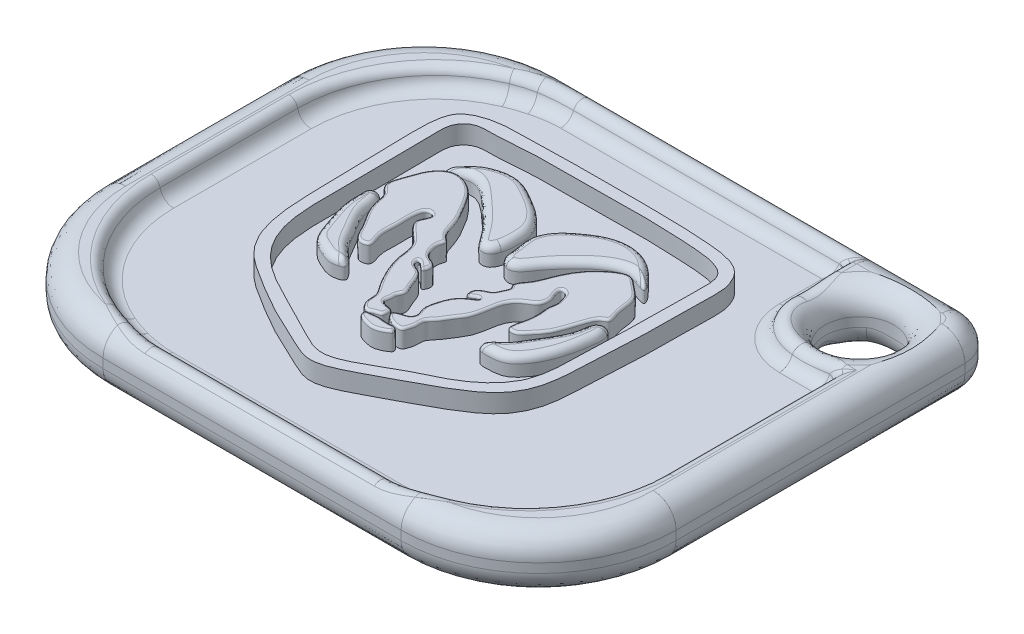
SolidWorks part; units mm, degrees
ref_plane "Ön Düzlem" through (0, 0, 0) normal (0, 0, 1) x (1, 0, 0)
ref_plane "Üst Düzlem" through (0, 0, 0) normal (0, 1, 0) x (1, 0, 0)
ref_plane "Sağ Düzlem" through (0, 0, 0) normal (1, 0, 0) x (0, 0, -1)
sketch "Çizim1" plane through (0, 0, 0) normal (0, 1, 0) x (1, 0, 0)
  line L1 (-41.6667, 37.8333) -> (53.3333, 37.8333)
  line L2 (-71.6667, 7.8333) -> (-71.6667, -32.1667)
  line L3 (-41.6667, -62.1667) -> (23.3333, -62.1667)
  line L4 (53.3333, 37.8333) -> (53.3333, -32.1667)
  arc A0 (23.3333, -62.1667) -> (53.3333, -32.1667) centre (23.3333, -32.1667) ccw
  arc A1 (-71.6667, -32.1667) -> (-41.6667, -62.1667) centre (-41.6667, -32.1667) ccw
  arc A2 (-41.6667, 37.8333) -> (-71.6667, 7.8333) centre (-41.6667, 7.8333) ccw
  circle A3 centre (38.3333, 22.8333) radius 7.5
  point P8 (-71.6667, -62.1667)
  point P11 (-71.6667, 37.8333)
  dimension "D3" = 30
  dimension "D4" = 15
  dimension "D1" = 100
  dimension "D2" = 125
  dimension "D5" = 15
extrude "Yükseklik-Ekstrüzyon1" add sketch "Çizim1" along normal blind 12
sketch "Çizim2" plane through (0, 12, 0) normal (0, 1, 0) x (1, 0, 0)
  line L0 (53.3333, 37.8333) -> (-41.6667, 37.8333) construction
  line L1 (-34.1667, 32.8333) -> (25.8333, 32.8333)
  line L2 (-64.1667, 2.8333) -> (-64.1667, -27.1667)
  line L3 (-34.1667, -57.1667) -> (15.8333, -57.1667)
  line L4 (45.8333, 10.8333) -> (45.8333, -27.1667)
  line L5 (-71.6667, 7.8333) -> (-71.6667, -32.1667) construction
  line L8 (25.8333, 32.8333) -> (25.8333, 20.8333)
  line L9 (35.8333, 10.8333) -> (45.8333, 10.8333)
  arc A0 (15.8333, -57.1667) -> (45.8333, -27.1667) centre (15.8333, -27.1667) ccw
  arc A1 (-64.1667, -27.1667) -> (-34.1667, -57.1667) centre (-34.1667, -27.1667) ccw
  arc A2 (-34.1667, 32.8333) -> (-64.1667, 2.8333) centre (-34.1667, 2.8333) ccw
  arc A3 (25.8333, 20.8333) -> (35.8333, 10.8333) centre (35.8333, 20.8333) ccw
  point P8 (-64.1667, -57.1667)
  point P11 (-64.1667, 32.8333)
  dimension "D3" = 30
  dimension "D8" = 10
  dimension "D1" = 90
  dimension "D2" = 110
  dimension "D4" = 5
  dimension "D5" = 7.5
extrude "Kes-Ekstrüzyon1" cut sketch "Çizim2" against normal blind 4
sketch "Çizim3" plane through (0, 0, 0) normal (0, -1, 0) x (1, 0, 0)
  line L0 (-41.6667, 62.1667) -> (23.3333, 62.1667) construction
  line L1 (-34.1667, 57.1667) -> (15.8333, 57.1667)
  line L2 (-64.1667, 27.1667) -> (-64.1667, -2.8333)
  line L3 (-34.1667, -32.8333) -> (25.8333, -32.8333)
  line L4 (45.8333, 27.1667) -> (45.8333, -10.8333)
  line L6 (-71.6667, -7.8333) -> (-71.6667, 32.1667) construction
  line L11 (25.8333, -32.8333) -> (25.8333, -20.8333)
  line L12 (35.8333, -10.8333) -> (45.8333, -10.8333)
  arc A0 (25.8333, -20.8333) -> (35.8333, -10.8333) centre (35.8333, -20.8333) cw
  arc A1 (-64.1667, -2.8333) -> (-34.1667, -32.8333) centre (-34.1667, -2.8333) ccw
  arc A2 (-34.1667, 57.1667) -> (-64.1667, 27.1667) centre (-34.1667, 27.1667) ccw
  arc A3 (15.8333, 57.1667) -> (45.8333, 27.1667) centre (15.8333, 27.1667) cw
  point P14 (25.8333, -10.8333)
  point P15 (-64.1667, -32.8333)
  point P18 (-64.1667, 57.1667)
  dimension "D7" = 10
  dimension "D1" = 30
  dimension "D2" = 90
  dimension "D3" = 5
  dimension "D4" = 7.5
  dimension "D5" = 22
  dimension "D6" = 20
extrude "Kes-Ekstrüzyon2" cut sketch "Çizim3" against normal blind 4
fillet "Radyus11" radius 5 15 edges at (5.8333, 12, -37.8333) (53.3333, 12, -2.8333) (44.5465, 12, 53.3799) (-9.1667, 12, 62.1667) (-62.8799, 12, 53.3799) (-71.6667, 12, 12.1667) (5.8333, 0, -37.8333) (53.3333, 0, -2.8333) (44.5465, 0, 53.3799) (-9.1667, 0, 62.1667) (-62.8799, 0, 53.3799) (-71.6667, 0, 12.1667) (38.3333, 12, -15.3333) (-62.8799, 12, -29.0465) (-62.8799, 0, -29.0465)
fillet "Radyus12" radius 5 1 edges at (38.3333, 0, -15.3333)
fillet "Radyus13" radius 3 10 edges at (-64.1667, 4, 12.1667) (-55.3799, 4, 48.3799) (-9.1667, 4, 57.1667) (37.0465, 4, 48.3799) (45.8333, 4, 8.1667) (40.8333, 4, -10.8333) (28.7623, 4, -13.7623) (25.8333, 4, -26.8333) (-4.1667, 4, -32.8333) (-55.3799, 4, -24.0465)
fillet "Radyus14" radius 3 2 edges at (25.8333, 0, -27.8333) (38.8331, 0.024, -10.8333)
fillet "Radyus15" radius 3 4 edges at (27.2654, 0.2614, -32.8333) (45.8333, 0.3856, -12.0869) (24.5654, 3.4495, -31.5654) (44.5447, 3.464, -9.5447)
fillet "Radyus18" radius 2 7 edges at (-55.3799, 12, -24.0465) (-64.1667, 12, 12.1667) (-9.1667, 12, 57.1667) (37.0465, 12, 48.3799) (-55.3799, 12, 48.3799) (-4.1667, 12, -32.8333) (45.8333, 12, 8.1667)
fillet "Radyus19" radius 7 3 edges at (51.8689, 1.4645, -36.3689) (51.8689, 10.5355, -36.3689) (53.3333, 6, -37.8333)
fillet "Radyus20" radius 3 10 edges at (40.8333, 8, -10.8333) (25.8333, 8, -26.8333) (-4.1667, 8, -32.8333) (45.8333, 8, 8.1667) (37.0465, 8, 48.3799) (-9.1667, 8, 57.1667) (-55.3799, 8, 48.3799) (-64.1667, 8, 12.1667) (28.7623, 8, -13.7623) (-55.3799, 8, -24.0465)
fillet "Radyus23" radius 2 6 edges at (44.8333, 12, -10.8333) (38.8333, 11.976, -10.8333) (25.8333, 12, -21.8333) (25.8333, 11.6709, -34.6174) (25.8333, 12, -27.8333)
fillet "Radyus24" radius 2 5 edges at (24.5399, 8.5327, -31.8614) (44.8317, 8.6762, -9.7307) (26.2034, 11.1204, -34.163) (46.5684, 11.5492, -11.4674)
sketch "Çizim4" plane through (0, 8, 0) normal (0, 1, 0) x (1, 0, 0)
  line L0 (151.5834, 553.2835) -> (951.5834, 553.2835) construction
  spline S0 degree 3 poles (15.953, 19.5866) (18.3588, 13.6674) (17.8839, 8.4144) (18.0922, 2.0295) (17.843, -6.304) (17.1688, -15.1893) (17.1255, -23.2659) (13.9873, -30.5642) (5.9124, -36.0113) (-2.628, -40.2402) (-9.3589, -43.9103) (-14.4223, -45.4916) (-20.4751, -42.3304) (-27.6236, -39.3057) (-34.4255, -34.9384) (-40.2998, -31.3335) (-43.5865, -26.0012) (-44.9039, -19.6326) (-45.122, -13.709) (-45.2462, -7.1627) (-45.4639, -1.3376) (-45.3847, 6.0632) (-45.8894, 11.8747) (-44.6406, 18.0281) (-38.8211, 20.7841) (-31.8787, 20.5257) (-21.3881, 20.9668) (-8.0529, 20.9111) (4.8279, 20.9052) (15.953, 19.5866) (18.3588, 13.6674) (17.8839, 8.4144) knots -0.133499 -0.058408 -0.019482 0 0.020891 0.051961 0.086482 0.133802 0.173147 0.194653 0.238604 0.299791 0.324988 0.343401 0.368235 0.412481 0.450536 0.477463 0.504761 0.532426 0.5649 0.585024 0.621189 0.643988 0.685035 0.701469 0.724204 0.763255 0.796423 0.866501 0.941592 0.980518 1 1.020891 1.051961 1.086482 only from (17.9684, 13.7831) to (17.9684, 13.7831)
  spline S1 degree 3 poles (-42.6128, -7.7362) (-42.7896, 5.0818) (-42.9813, 15.1106) (-40.2853, 17.8545) (-35.8586, 17.5748) (-28.8839, 18.4449) (-19.9801, 18.1643) (-7.4294, 18.5933) (2.6937, 18.4183) (15.4637, 17.4118) (15.3469, 7.3012) (15.3811, -2.076) (14.6546, -14.2547) (14.9138, -25.0869) (7.3638, -32.8571) (-1.3545, -36.226) (-7.9311, -40.5853) (-14.3, -43.1101) (-19.9203, -40.0129) (-28.1594, -35.6847) (-37.0032, -31.8464) (-42.806, -21.8925) (-42.6128, -7.7362) (-42.7896, 5.0818) (-42.9813, 15.1106) knots -0.198126 -0.17852 -0.109927 0 0.016984 0.031549 0.050026 0.078671 0.135548 0.180319 0.258801 0.304453 0.322538 0.393706 0.448328 0.501615 0.544201 0.596306 0.637495 0.66139 0.690583 0.724591 0.801874 0.82148 0.890073 1 1.016984 1.031549 1.050026 only from (-42.9165, 11.6824) to (-42.9165, 11.6824)
  spline S2 degree 3 poles (-38.5956, -4.7526) (-40.4193, -5.2577) (-40.349, -7.8522) (-40.4349, -11.5939) (-38.6653, -16.0872) (-37.2614, -20.6435) (-33.8173, -22.0978) (-31.4921, -23.2184) (-28.4429, -22.2119) (-29.9572, -20.0154) (-32.2543, -18.5594) (-33.7881, -15.3796) (-35.725, -12.4024) (-37.1194, -9.4402) (-37.1033, -6.4809) (-38.5956, -4.7526) (-40.4193, -5.2577) (-40.349, -7.8522) knots -0.128638 -0.065663 -0.026352 0 0.035588 0.121646 0.259343 0.349759 0.417091 0.489456 0.534745 0.560539 0.63396 0.725158 0.781078 0.871362 0.934337 0.973648 1 1.035588 1.121646 1.259343 only from (-40.0457, -5.3522) to (-40.0457, -5.3522)
  spline S3 degree 3 poles (1.9639, -20.8216) (0.5277, -23.4037) (4.3414, -23.3852) (7.1178, -22.9425) (9.6167, -20.0988) (11.1695, -16.9355) (12.2642, -13.5398) (12.7091, -10.2227) (13.16, -7.7059) (12.1716, -5.3209) (9.3603, -6.4757) (9.5169, -9.637) (7.8023, -13.2184) (5.7054, -16.4703) (3.8768, -19.6552) (1.9639, -20.8216) (0.5277, -23.4037) (4.3414, -23.3852) knots -0.157564 -0.085788 -0.040297 0 0.05677 0.129777 0.206129 0.287264 0.365861 0.440463 0.506752 0.539965 0.581304 0.653722 0.728231 0.842436 0.914212 0.959703 1 1.05677 1.129777 1.206129 only from (1.2373, -22.8005) to (1.2373, -22.8005)
  spline S4 degree 3 poles (-17.1886, -29.3504) (-17.1884, -30.933) (-15.3998, -31.4733) (-13.192, -32.0636) (-11.49, -31.3593) (-9.9225, -30.2481) (-10.8734, -28.9855) (-12.6063, -29.5127) (-14.5196, -28.9394) (-15.9168, -29.4579) (-17.1886, -29.3504) (-17.1884, -30.933) (-15.3998, -31.4733) knots -0.195493 -0.088292 -0.041927 0 0.145433 0.250946 0.436948 0.495474 0.552563 0.662248 0.804507 0.911708 0.958073 1 1.145433 1.250946 1.436948 only from (-17.1312, -30.1859) to (-17.1312, -30.1859)
  spline S5 degree 3 poles (-14.1736, -26.8895) (-13.5045, -28.1075) (-12.3648, -28.6738) (-11.1148, -29.0447) (-9.5865, -29.1295) (-9.2235, -27.708) (-8.7993, -26.4569) (-9.1293, -24.7588) (-7.452, -23.322) (-6.5362, -21.3555) (-4.5835, -18.9706) (-4.0883, -15.7325) (-3.5188, -12.3799) (-1.6462, -10.4146) (0.673, -9.4411) (1.1722, -6.8466) (0.1796, -5.5759) (0.0942, -3.8954) (1.7122, -4.3591) (2.028, -5.8089) (2.5449, -7.3315) (1.9964, -8.886) (2.4102, -10.994) (2.2974, -13.2973) (1.6346, -15.2825) (1.3535, -17.4254) (3.8354, -17.4654) (5.0986, -15.4721) (6.7851, -13.7621) (7.9254, -10.9492) (8.8465, -8.2545) (9.641, -5.5197) (11.7489, -4.6319) (10.0974, -1.4185) (10.7179, 2.2328) (7.5709, 4.3489) (5.1445, 6.6474) (1.9578, 4.6777) (-0.9892, 1.957) (-3.1867, -2.045) (-4.258, -5.7365) (-5.762, -7.3262) (-6.1859, -8.5216) (-5.3406, -9.3794) (-6.0831, -10.6561) (-6.5699, -12.3526) (-8.6957, -12.7534) (-9.5265, -14.2099) (-9.1555, -15.5891) (-8.0898, -15.2069) (-7.6138, -14.5117) (-6.7653, -14.9112) (-8.0766, -15.8085) (-9.0804, -16.3918) (-10.4312, -18.2125) (-11.0585, -20.3495) (-11.6523, -22.7349) (-10.5777, -24.4196) (-11.1891, -25.7316) (-12.3464, -25.9818) (-13.2745, -26.295) (-14.1736, -26.8895) (-13.5045, -28.1075) (-12.3648, -28.6738) knots -0.022932 -0.014096 -0.008717 0 0.012016 0.023245 0.033013 0.044149 0.053586 0.066802 0.082394 0.102899 0.120715 0.156677 0.181251 0.202585 0.220341 0.240577 0.254937 0.263076 0.270585 0.284629 0.297896 0.309184 0.323266 0.350139 0.363154 0.378687 0.389501 0.411162 0.43311 0.448697 0.484489 0.505492 0.514053 0.533347 0.572695 0.601332 0.619948 0.647966 0.677046 0.7229 0.757087 0.768596 0.777394 0.784403 0.793767 0.809128 0.825824 0.840141 0.846921 0.853049 0.86236 0.865218 0.870232 0.888758 0.902499 0.92214 0.944568 0.959649 0.965626 0.977068 0.985904 0.991283 1 1.012016 1.023245 1.033013 only from (-13.5523, -27.8476) to (-13.5523, -27.8476)
  spline S6 degree 3 poles (-19.3296, -27.8085) (-17.2859, -29.6325) (-16.0136, -28.5194) (-14.6202, -28.4669) (-14.4213, -27.2638) (-14.6362, -26.0111) (-16.0678, -26.2638) (-17.3472, -25.3643) (-16.7493, -24.1433) (-17.0274, -22.9415) (-15.8488, -21.5058) (-17.2658, -19.4661) (-17.6985, -17.4105) (-19.0815, -15.7104) (-20.7395, -15.6622) (-21.1398, -13.8508) (-19.7759, -14.6802) (-18.8278, -15.9598) (-17.9798, -13.9986) (-18.9095, -12.8093) (-20.6703, -12.4988) (-21.72, -10.5759) (-21.8869, -8.8526) (-21.2252, -7.4399) (-23.3732, -6.1259) (-23.7663, -2.8076) (-25.9958, 0.7299) (-27.7833, 3.9121) (-30.4897, 5.9918) (-33.9954, 6.7911) (-36.9923, 3.8744) (-37.9178, 0.3531) (-39.639, -3.5443) (-37.0498, -5.056) (-36.6977, -7.3875) (-35.8264, -10.4832) (-33.4424, -13.293) (-31.9814, -17.374) (-28.6452, -16.3799) (-30.4467, -13.1411) (-29.7317, -9.7315) (-30.2253, -6.7235) (-29.5706, -3.3844) (-26.9256, -4.3715) (-29.2216, -6.6047) (-27.6434, -8.8489) (-26.0128, -10.0506) (-23.9499, -12.2285) (-23.9707, -16.0303) (-22.3615, -19.7631) (-20.6534, -22.923) (-18.7309, -25.2342) (-19.3296, -27.8085) (-17.2859, -29.6325) (-16.0136, -28.5194) knots -0.06043 -0.037545 -0.017783 0 0.010141 0.019671 0.029774 0.035284 0.047763 0.057447 0.06669 0.076169 0.086516 0.106515 0.126858 0.140128 0.156357 0.162664 0.17092 0.181933 0.194528 0.203474 0.216282 0.235636 0.250875 0.259598 0.267737 0.303685 0.336156 0.370252 0.391562 0.41898 0.449684 0.480349 0.515559 0.529555 0.544916 0.570642 0.607041 0.640789 0.651996 0.673779 0.706435 0.738631 0.757218 0.766041 0.789328 0.802084 0.826858 0.840913 0.87303 0.913885 0.93957 0.962455 0.982217 1 1.010141 1.019671 1.029774 only from (-17.0591, -29.1551) to (-17.0591, -29.1551)
  spline S7 degree 3 poles (-33.75, 9.8013) (-36.3129, 6.2926) (-34.4256, 6.9363) (-33.0253, 7.2797) (-30.9156, 7.9244) (-28.2882, 6.8688) (-25.6359, 4.388) (-22.0338, 1.271) (-19.5271, -1.8066) (-17.8278, -4.34) (-15.6071, -4.3341) (-14.3976, -1.9925) (-14.2932, 0.8683) (-14.3443, 4.1915) (-16.6473, 7.9024) (-20.8028, 10.4436) (-25.5931, 13.1948) (-31.5079, 11.7661) (-33.75, 9.8013) (-36.3129, 6.2926) (-34.4256, 6.9363) knots -0.202245 -0.120502 -0.023538 0 0.017376 0.044731 0.085859 0.117861 0.18146 0.266769 0.354019 0.385557 0.408765 0.450486 0.498235 0.555878 0.611845 0.707568 0.797755 0.879498 0.976462 1 1.017376 1.044731 1.085859 only from (-35.8013, 6.6081) to (-35.8013, 6.6081)
  spline S8 degree 3 poles (-11.4333, 6.954) (-13.0216, 4.4309) (-13.675, 1.6136) (-12.8647, -1.0347) (-12.9397, -3.963) (-9.7139, -5.5182) (-7.0417, -1.068) (-4.1403, 2.0477) (-0.8986, 5.2804) (2.7496, 7.3717) (5.2516, 6.9512) (8.3336, 5.633) (7.8145, 7.2134) (6.5513, 8.5407) (4.5229, 10.7407) (0.7617, 12.4319) (-4.1715, 12.0953) (-8.3347, 9.4556) (-11.4333, 6.954) (-13.0216, 4.4309) (-13.675, 1.6136) knots -0.197826 -0.110342 -0.041917 0 0.037075 0.09834 0.139814 0.169587 0.247421 0.341293 0.40072 0.478918 0.525079 0.562047 0.566462 0.601543 0.655096 0.714487 0.802174 0.889658 0.958083 1 1.037075 1.09834 1.139814 only from (-12.9377, 4.2819) to (-12.9377, 4.2819)
extrude "Yükseklik-Ekstrüzyon2" add sketch "Çizim4" along normal blind 4 contours S7 | S0 S1 | S8 | S5 | S3 | S2 | S6 | S4
fillet "Radyus25" radius 1.5 4 edges
fillet "Radyus26" radius 0.5 3 edges
